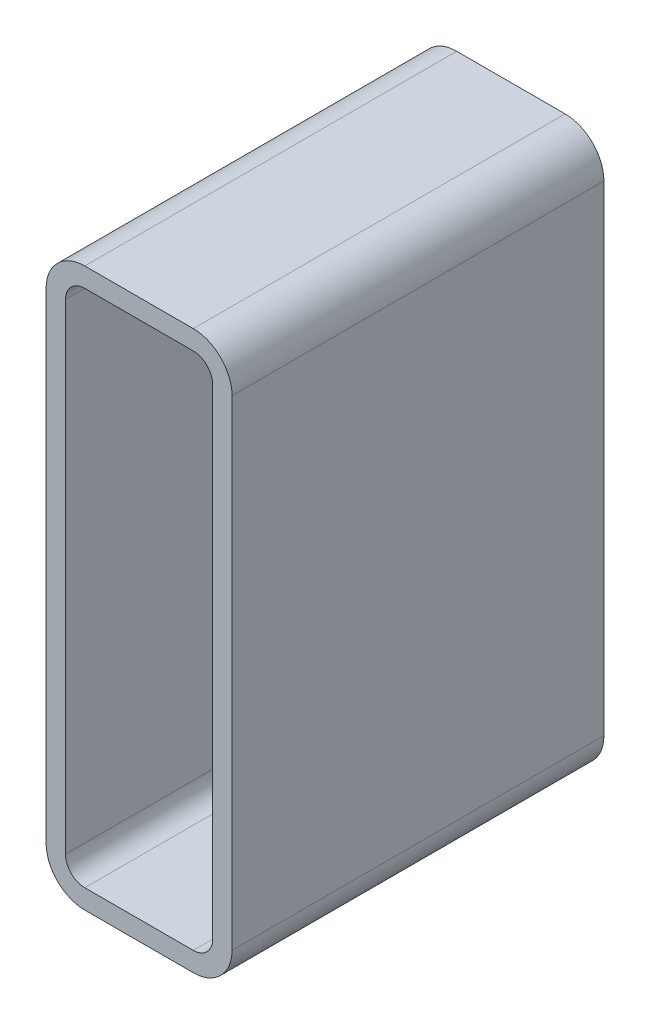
SolidWorks part; units mm, degrees
ref_plane "Front Plane" through (0, 0, 0) normal (0, 0, 1) x (1, 0, 0)
ref_plane "Top Plane" through (0, 0, 0) normal (0, 1, 0) x (1, 0, 0)
ref_plane "Right Plane" through (0, 0, 0) normal (1, 0, 0) x (0, 0, -1)
sketch "Sketch1" plane through (0, 0, 0) normal (0, 0, 1) x (1, 0, 0)
sketch_block_instance "HSS18x6x0.625-1"
sketch_block "HSS18x6x0.625"
extrude "Boss-Extrude1" add sketch "Sketch1" along normal blind 304.8
